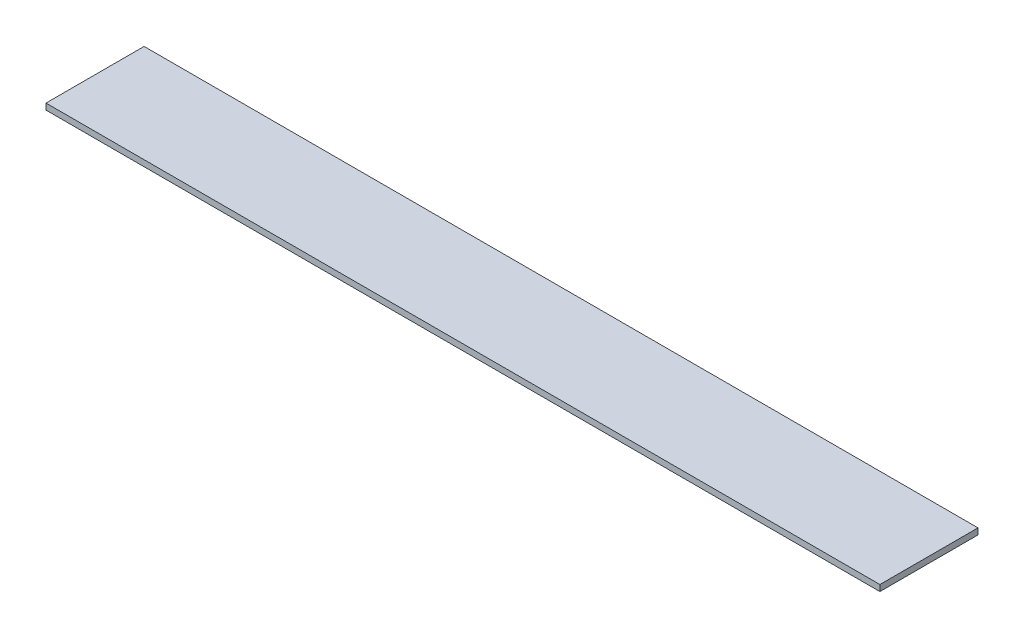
SolidWorks part; units mm, degrees
ref_plane "Front Plane" through (0, 0, 0) normal (0, 0, 1) x (1, 0, 0)
ref_plane "Top Plane" through (0, 0, 0) normal (0, 1, 0) x (1, 0, 0)
ref_plane "Right Plane" through (0, 0, 0) normal (1, 0, 0) x (0, 0, -1)
sketch "Sketch1" plane through (0, 0, 0) normal (0, 1, 0) x (1, 0, 0)
  line L1 (-215.9, -25.4) -> (215.9, -25.4)
  line L2 (-215.9, -25.4) -> (-215.9, 25.4)
  line L3 (-215.9, 25.4) -> (215.9, 25.4)
  line L4 (215.9, -25.4) -> (215.9, 25.4)
  line L5 (-215.9, -25.4) -> (215.9, 25.4) construction
  line L6 (-215.9, 25.4) -> (215.9, -25.4) construction
  point P0 (0, 0)
  dimension "D1" = 431.8
  dimension "D2" = 50.8
extrude "Boss-Extrude1" add sketch "Sketch1" along normal blind 3.175
